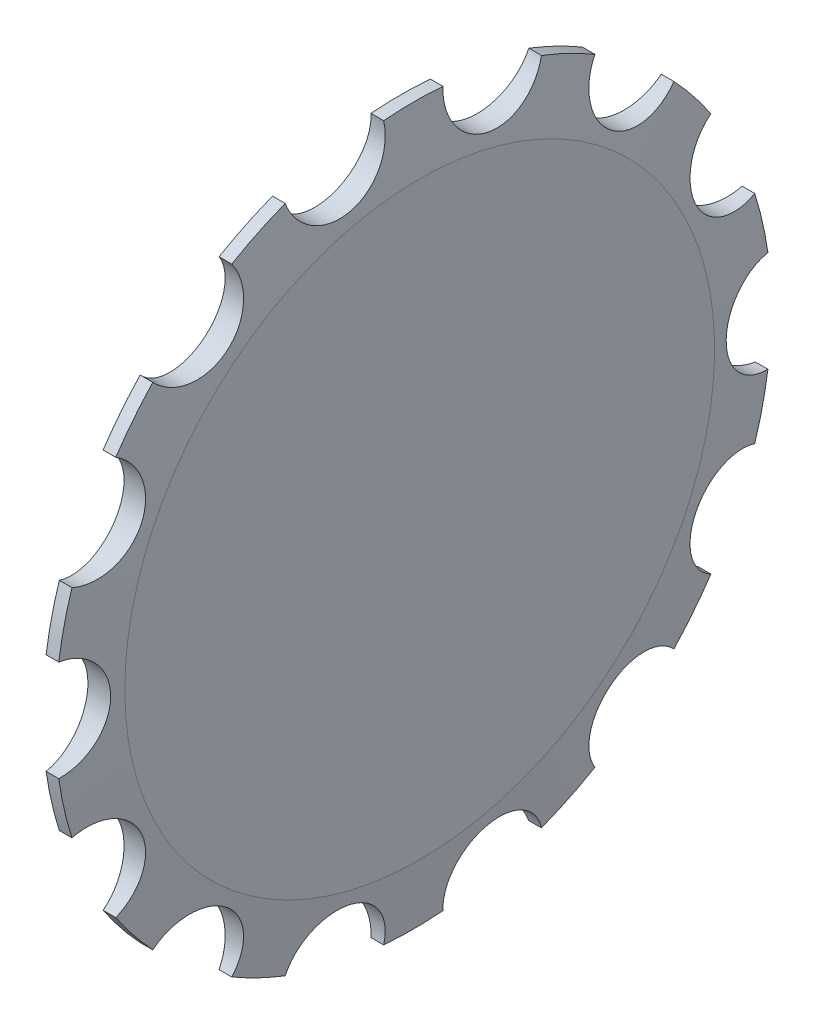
SolidWorks part; units mm, degrees
ref_plane "Plan1" through (0, 0, 0) normal (0, 0, 1) x (1, 0, 0)
ref_plane "Plan2" through (0, 0, 0) normal (0, 1, 0) x (1, 0, 0)
ref_plane "Plan3" through (0, 0, 0) normal (1, 0, 0) x (0, 0, -1)
sketch "Esquisse1" plane through (0, 0, 0) normal (0, 0, 1) x (1, 0, 0)
  line L0 (-40, -2.3) -> (50, -2.3) construction
  line L1 (-0.9958, -2.3) -> (1.0042, -2.3)
  line L2 (1.0042, -2.3) -> (1.0042, 21)
  line L4 (-0.9958, -2.3) -> (-0.9958, 21)
  line L5 (-0.5, 26) -> (0.5, 26)
  line L7 (-0.9958, 21) -> (-0.5, 26)
  line L8 (1.0042, 21) -> (0.5, 26)
  dimension "D2" = 2
  dimension "D3" = 28.3
revolve "Base-Révolution" add sketch "Esquisse1" angle 360 about L0
sketch "Esquisse2" plane through (1.0042, 0, 0) normal (1, 0, 0) x (0, 0, -1)
  line L0 (1.1033, -2.3) -> (-31.6283, -2.3) construction
  line L1 (0, -2.3) -> (0, 30) construction
  circle A0 centre (-28.3184, -2.3) radius 4
  circle A1 centre (-25.514, -14.5869) radius 4
  circle A2 centre (-17.6562, -24.4402) radius 4
  circle A3 centre (-6.3014, -29.9084) radius 4
  circle A4 centre (6.3014, -29.9084) radius 4
  circle A5 centre (17.6562, -24.4402) radius 4
  circle A6 centre (25.514, -14.5869) radius 4
  circle A7 centre (28.3184, -2.3) radius 4
  circle A8 centre (25.514, 9.9869) radius 4
  circle A9 centre (17.6562, 19.8402) radius 4
  circle A10 centre (6.3014, 25.3084) radius 4
  circle A11 centre (-6.3014, 25.3084) radius 4
  circle A12 centre (-17.6562, 19.8402) radius 4
  circle A13 centre (-25.514, 9.9869) radius 4
  dimension "D1" = 8
extrude "Enlèv. mat.-Extru.1" cut sketch "Esquisse2" against normal through all
